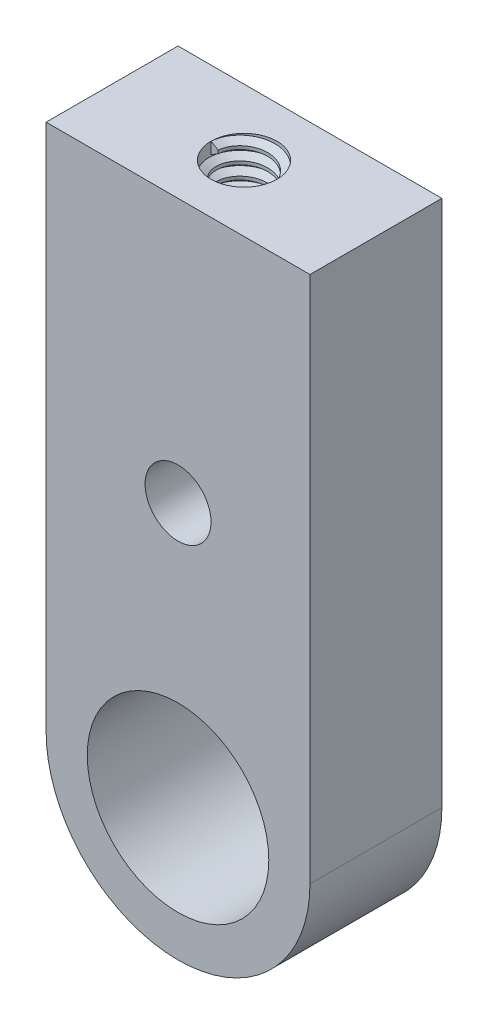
SolidWorks part; units mm, degrees
ref_plane "Front Plane" through (0, 0, 0) normal (0, 0, 1) x (1, 0, 0)
ref_plane "Top Plane" through (0, 0, 0) normal (0, 1, 0) x (1, 0, 0)
ref_plane "Right Plane" through (0, 0, 0) normal (1, 0, 0) x (0, 0, -1)
sketch "Sketch1" plane through (0, 0, 0) normal (0, 0, 1) x (1, 0, 0)
  line L1 (0, 0) -> (25.4, 0)
  line L2 (0, 0) -> (0, 63.5)
  line L3 (0, 63.5) -> (25.4, 63.5)
  line L4 (25.4, 0) -> (25.4, 63.5)
  dimension "D1" = 25.4
  dimension "D2" = 63.5
extrude "Boss-Extrude1" add sketch "Sketch1" along normal blind 12.7
sketch "Sketch2" plane through (0, 0, 12.7) normal (0, 0, 1) x (1, 0, 0)
  line L0 (12.7, 0) -> (12.7, 12.7) construction
  line L1 (0, 0) -> (25.4, 0) construction
  line L2 (12.7, 12.7) -> (12.7, 38.1) construction
  circle A0 centre (12.7, 12.7) radius 8.7376
  circle A1 centre (12.7, 38.1) radius 3.175
  dimension "D1" = 17.4752
  dimension "D3" = 6.35
  dimension "D2" = 12.7
  dimension "D4" = 25.4
extrude "Cut-Extrude1" cut sketch "Sketch2" against normal through all
sketch "Sketch3" plane through (0, 63.5, 0) normal (0, 1, 0) x (1, 0, 0)
  line L0 (12.7, -6.35) -> (0, -6.35) construction
  line L1 (0, -12.7) -> (0, 0) construction
  line L2 (12.7, -6.35) -> (25.4, -6.35) construction
  line L3 (25.4, -12.7) -> (25.4, 0) construction
  line L4 (12.7, -6.35) -> (12.7, 0) construction
  line L5 (25.4, 0) -> (0, 0) construction
  line L6 (12.7, -6.35) -> (12.7, -12.7) construction
  line L7 (25.4, -12.7) -> (0, -12.7) construction
  circle A0 centre (12.7, -6.35) radius 3.175
  dimension "D1" = 6.35
extrude "Cut-Extrude2" cut sketch "Sketch3" against normal blind 19.05
thread "1/4-20 threaded hole" pitch 1.27 start angle 0, offset 0, length 19.05, pitch 1.27, diameter 6.35
ref_plane "Plane1" through (9.525, 63.5, 6.35) normal (0, 0, 1) x (-1, 0, 0)
sketch "Thread Profile1" plane through (9.525, 63.5, 6.35) normal (0, 0, 1) x (-1, 0, 0)
  line L0 (0, 0) -> (0, 1.27) construction
  line L11 (0, 0) -> (0, 1.1112)
  line L12 (0, 1.1112) -> (-0.6874, 0.7144)
  line L13 (-0.6874, 0.7144) -> (-0.6874, 0.3969)
  line L15 (-0.6874, 0.3969) -> (0, 0)
  line L17 (-0.6874, 0.5556) -> (0, 0.5556) construction
  point P2 (0, 0)
  dimension "Pitch" = 1.27
  dimension "Profile_Angle" = 60
  dimension "Profile_Land" = 0.3175
  dimension "Profile_Height" = 0.6874
fillet "Fillet1" radius 12.7 2 edges at (25.4, 0, 6.35) (0, 0, 6.35)
